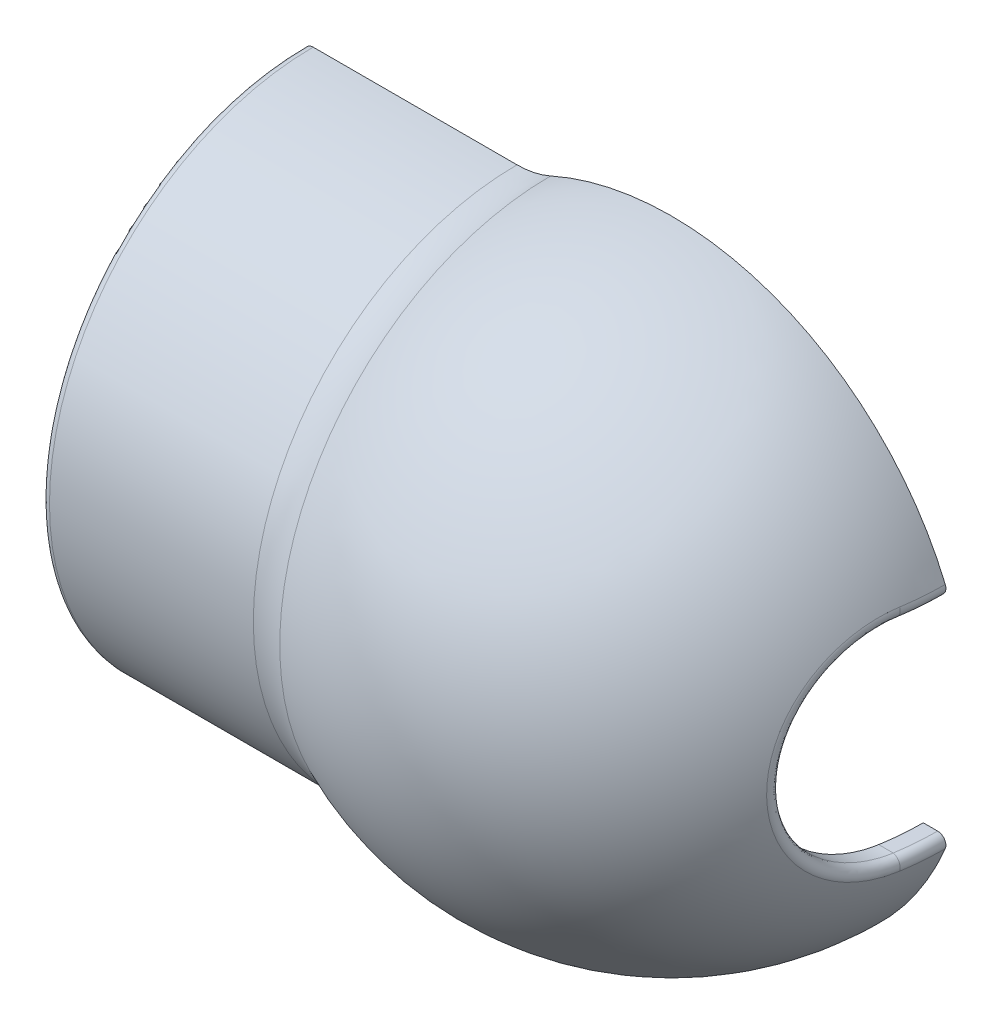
SolidWorks part; units mm, degrees
ref_plane "Plan de face" through (0, 0, 0) normal (0, 0, 1) x (1, 0, 0)
ref_plane "Plan de dessus" through (0, 0, 0) normal (0, 1, 0) x (1, 0, 0)
ref_plane "Plan de droite" through (0, 0, 0) normal (1, 0, 0) x (0, 0, -1)
imported_body "Stock-Coque de base-1"
sketch "Esquisse1" plane through (0, 0, 0) normal (1, 0, 0) x (0, 0, -1)
  line L0 (0, 0) -> (-16.0949, 0) construction
  line L1 (0, 12.5) -> (-5, 12.5)
  line L2 (0, -36) -> (0, 36) construction
  line L3 (-5, -12.5) -> (0, -12.5)
  line L4 (0, -12.5) -> (0, 12.5)
  arc A0 (-5, 12.5) -> (-5, -12.5) centre (-5, 0) ccw
  dimension "D1" = 25
  dimension "D2" = 5
extrude "Enlèv. mat.-Extru.1" cut sketch "Esquisse1" along normal through all
fillet "Congé1" radius 1 1 edges at (-44.5, 0, 32)
fillet "Congé2" radius 1 3 edges at (33.667, 12.5, 2.5069) (31.4759, -1.5634, 17.4018) (33.667, -12.5, 2.5069)
